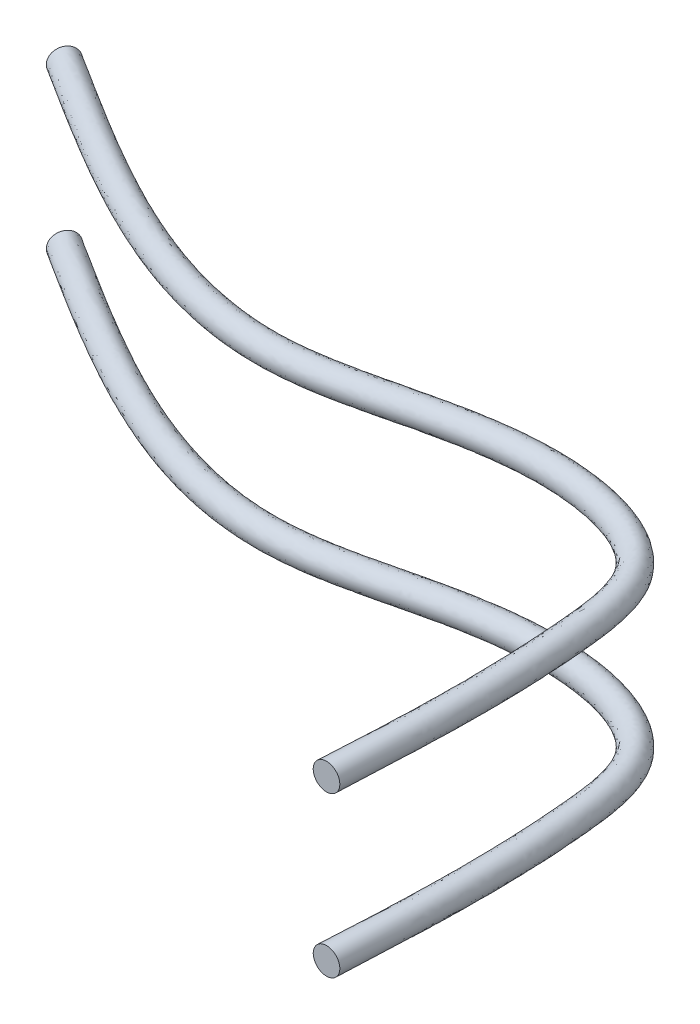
SolidWorks part; units mm, degrees
ref_plane "Plan de face" through (0, 0, 0) normal (0, 0, 1) x (1, 0, 0)
ref_plane "Plan de dessus" through (0, 0, 0) normal (0, 1, 0) x (1, 0, 0)
ref_plane "Plan de droite" through (0, 0, 0) normal (1, 0, 0) x (0, 0, -1)
sketch "Esquisse1" plane through (0, 0, 0) normal (0, 0, 1) x (1, 0, 0)
  line L1 (5.9832, 0) -> (-21.409, 0) construction
  line L2 (-17.75, -5) -> (-17.75, 5) construction
  circle A0 centre (-17.25, 1.5) radius 0.25
  circle A1 centre (-17.25, -1.5) radius 0.25
  dimension "D1" = 0.5
  dimension "D2" = 3
  dimension "D3" = 0.5
sketch "Esquisse2" plane through (0, 0, 0) normal (0, 1, 0) x (1, 0, 0)
  line L0 (5.9832, 0) -> (-21.409, 0) construction
  spline S0 degree 3 poles (-17.2779, 0) (-17.1991, 1.5293) (-17.0952, 3.5432) (-17.5295, 6.6596) (-20.8805, 7.5141) (-25.4203, 5.3746) (-29.0874, 7.7039) (-31.3681, 9.1525) knots 0 0 0 0 0.227189 0.299166 0.424008 0.641775 1 1 1 1
sweep "Balayage1" add profiles "Esquisse1" path "Esquisse2"
